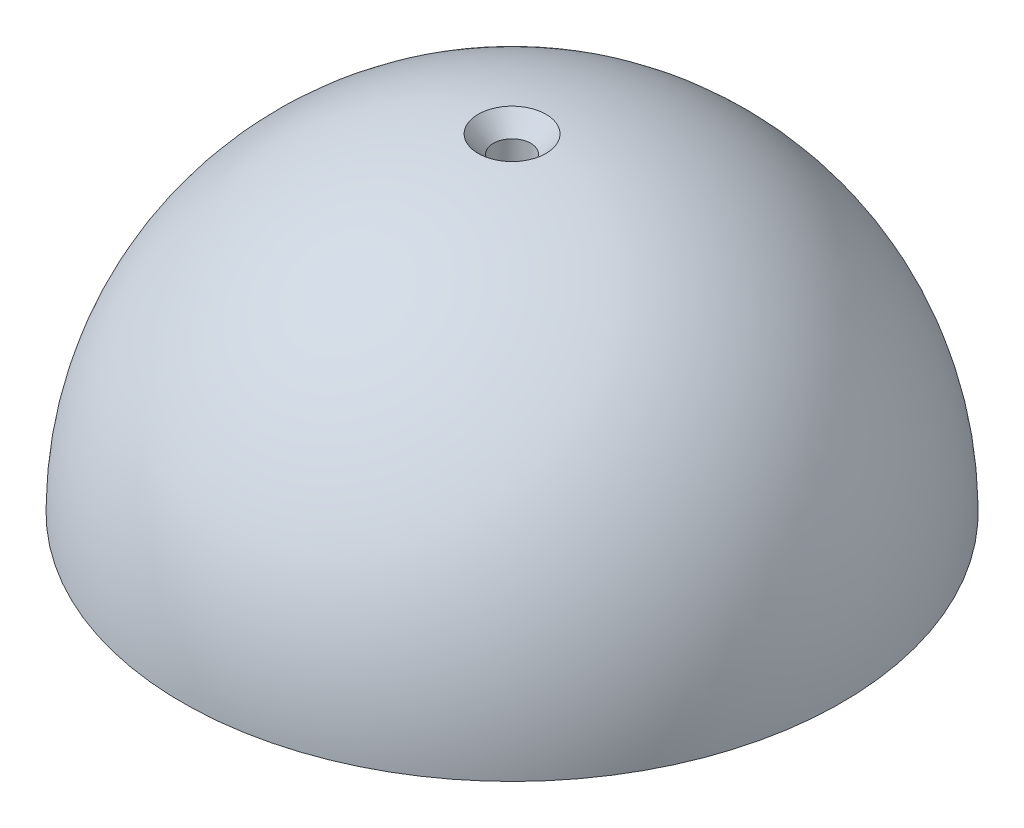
SolidWorks part; units mm, degrees
ref_plane "Front Plane" through (0, 0, 0) normal (0, 0, 1) x (1, 0, 0)
ref_plane "Top Plane" through (0, 0, 0) normal (0, 1, 0) x (1, 0, 0)
ref_plane "Right Plane" through (0, 0, 0) normal (1, 0, 0) x (0, 0, -1)
sketch "Sketch1" plane through (0, 0, 0) normal (0, 0, 1) x (1, 0, 0)
  line L0 (0, 0) -> (0, 55.88) construction
  line L1 (0, 0) -> (55.88, 0)
  line L2 (0, 0) -> (0, 55.88)
  arc A0 (0, 55.88) -> (55.88, 0) centre (0, 0) cw
  dimension "D3" = 55.88
  dimension "D1" = 55.88
  dimension "D2" = 55.88
revolve "Revolve1" add sketch "Sketch1" angle 360 about L0
sketch "Sketch2" plane through (0, 0, 0) normal (0, 1, 0) x (1, 0, 0)
  circle A0 centre (0, 0) radius 3.175
  dimension "D1" = 6.35
extrude "Cut-Extrude1" cut sketch "Sketch2" along normal through all
chamfer "Chamfer1" distance 3.175 angle 41 1 edges at (0, 55.7897, -3.175)
